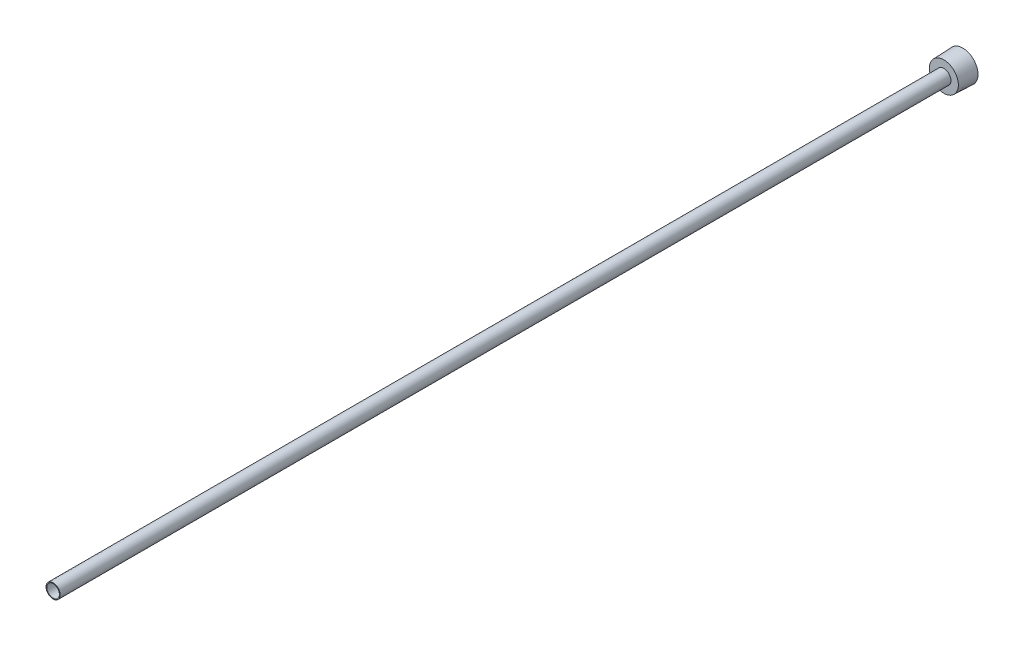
SolidWorks part; units mm, degrees
ref_plane "Front Plane" through (0, 0, 0) normal (0, 0, 1) x (1, 0, 0)
ref_plane "Top Plane" through (0, 0, 0) normal (0, 1, 0) x (1, 0, 0)
ref_plane "Right Plane" through (0, 0, 0) normal (1, 0, 0) x (0, 0, -1)
sketch "Sketch1" plane through (0, 0, 0) normal (1, 0, 0) x (0, 0, -1)
  line L5 (0, 0) -> (0, 5.0927)
  line L6 (0, 5.0927) -> (-6.35, 4.8611)
  line L7 (-6.35, 4.8611) -> (-6.35, 2.3749)
  line L8 (-6.35, 2.3749) -> (-304.8, 2.3749)
  line L9 (-304.8, 2.3749) -> (-304.8, 0)
  line L10 (0, 0) -> (50000, 0) construction
  line L11 (0, 0) -> (-304.8, 0)
  dimension "D1" = 4.7498
  dimension "D2" = 10.1854
  dimension "D3" = 2.089
  dimension "D4" = 6.35
  dimension "D5" = 304.8
revolve "Revolve1" add sketch "Sketch1" angle 360 about L10
sketch "Sketch2" plane through (0, 0, 304.8) normal (0, 0, 1) x (1, 0, 0)
  circle A0 centre (0, 0) radius 2.1209
  dimension "D1" = 4.2418
extrude "Cut-Extrude1" cut sketch "Sketch2" against normal through all
sketch "Sketch3" plane through (0, 0, 0) normal (0, 0, -1) x (-1, 0, 0)
  line L0 (0, 5.602) -> (0, -5.602) construction
  line L1 (0, -3.6662) -> (3.175, -1.8331)
  line L2 (3.175, -1.8331) -> (3.175, 1.8331)
  line L3 (3.175, 1.8331) -> (0, 3.6662)
  line L4 (0, 3.6662) -> (-3.175, 1.8331)
  line L5 (-3.175, 1.8331) -> (-3.175, -1.8331)
  line L6 (-3.175, -1.8331) -> (0, -3.6662)
  circle A0 centre (0, 0) radius 3.175 construction
  dimension "D1" = 6.35
extrude "Cut-Extrude2" cut sketch "Sketch3" against normal blind 4.7625
